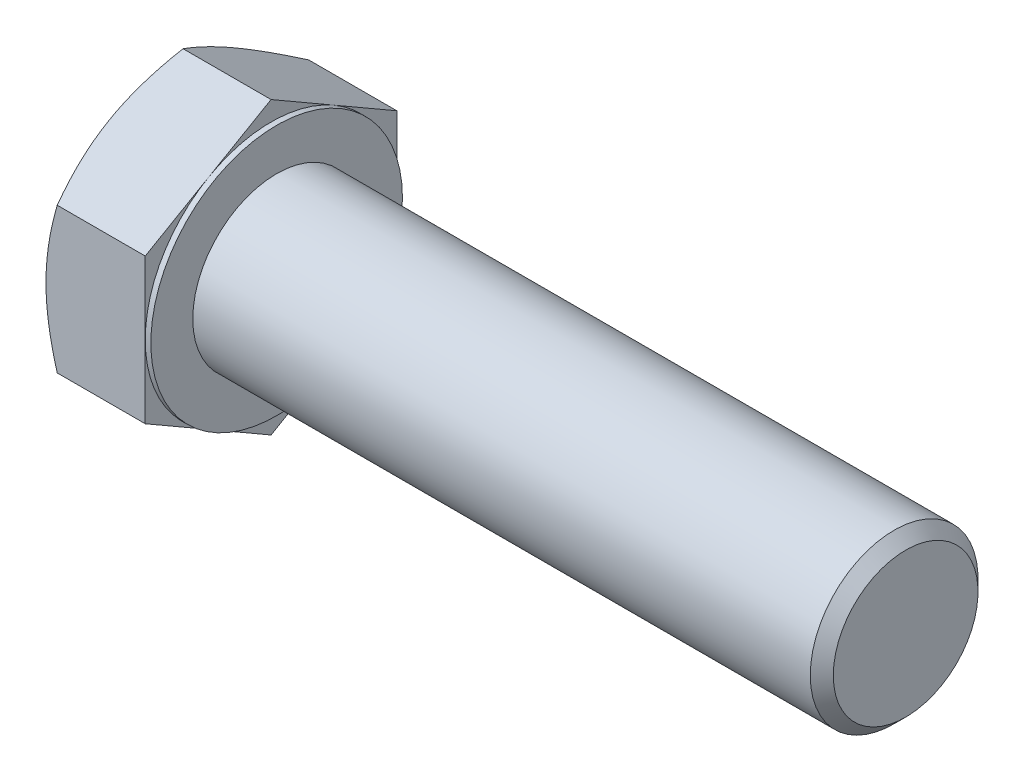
SolidWorks part; units mm, degrees
extrude "BaseHead" add sketch "Sketch1" along normal blind 15
sketch "Sketch1" plane through (0, 0, 0) normal (1, 0, 0) x (0, 0, -1)
  line L0 (18, 10.3923) -> (18, -10.3923)
  line L1 (-18, 10.3923) -> (-18, -10.3923)
  line L2 (18, -10.3923) -> (0, -20.7846)
  line L3 (0, -20.7846) -> (-18, -10.3923)
  line L4 (18, 10.3923) -> (0, 20.7846)
  line L5 (0, 20.7846) -> (-18, 10.3923)
revolve "HeadChamfer" cut sketch "Sketch3" angle 360 about L6
sketch "Sketch3" plane through (0, 0, 0) normal (0, 0, 1) x (1, 0, 0)
  line L0 (0, 18) -> (4.4944, 25.7846)
  line L1 (0, 20.7846) -> (0, 10.3923) construction
  line L2 (4.4944, 25.7846) -> (4.4944, 30.7846)
  line L3 (4.4944, 30.7846) -> (-10, 30.7846)
  line L4 (-10, 30.7846) -> (-10, 18)
  line L5 (-10, 18) -> (0, 18)
  line L6 (0, 0) -> (99.06, 0) construction
  line L7 (15, 20.7846) -> (0, 20.7846) construction
ref_plane "Plane1" through (0, 0, 0) normal (0, 0, 1) x (1, 0, 0)
ref_plane "Plane2" through (0, 0, 0) normal (0, 1, 0) x (1, 0, 0)
ref_plane "Plane3" through (0, 0, 0) normal (1, 0, 0) x (0, 0, -1)
sketch "BodySke" plane through (0, 0, 0) normal (0, 0, 1) x (1, 0, 0)
  line L0 (0, 10.3923) -> (0, -10.3923) construction
  line L1 (0, 0) -> (105, 0)
  line L2 (0, 0) -> (0, 12)
  line L3 (0, 12) -> (103.352, 12)
  line L4 (105, 0) -> (105, 10.352)
  line L5 (15, 20.7846) -> (15, 10.3923) construction
  line L6 (105, 10.352) -> (103.352, 12)
  line L7 (0, 0) -> (96.52, 0) construction
  line L8 (105, -10.352) -> (103.352, -12) construction
  line L9 (0, -12) -> (103.352, -12) construction
  line L10 (18, 15.24) -> (18, -1.27) construction
  line L11 (51, 15.24) -> (51, -1.27) construction
  line L12 (15, 10.3923) -> (15, -10.3923) construction
revolve "BaseBody" add sketch "BodySke"
fillet "HeadFillet" [suppressed] radius 0.8
sketch "Sketch4" plane through (0, 0, 0) normal (0, 0, 1) x (1, 0, 0)
  line L1 (15, 20.7846) -> (15, 10.3923) construction
  line L2 (15, 18) -> (14.2, 18)
  line L3 (15, 18) -> (15, 30.7846)
  line L4 (15, 30.7846) -> (14.2, 30.7846)
  line L5 (0, 0) -> (95.25, 0) construction
  line L6 (0, 0) -> (96.52, 0) construction
  line L7 (14.2, 18) -> (14.2, 30.7846)
  line L8 (15, 20.7846) -> (1.6077, 20.7846) construction
revolve "BearingFace" cut sketch "Sketch4" angle 360 about L5
sketch "ThdSchSke" plane through (0, 0, 0) normal (0, 0, 1) x (1, 0, 0)
  line L0 (51, -10.352) -> (49.8461, -12)
  line L1 (51, -10.352) -> (52.1539, -12)
  line L2 (52.1539, -12) -> (52.1539, -15)
  line L3 (-3.175, 0) -> (5.1513, 0) construction
  line L5 (52.1539, -15) -> (49.8461, -15)
  line L6 (49.8461, -15) -> (49.8461, -12)
revolve "ThreadSchematic" [suppressed] cut sketch "ThdSchSke" angle 360 about L3
pattern_linear "ThdSchPat" [suppressed]
equation "\"D3@Sketch1\" = \"Width_flats@Sketch1\" / 2"
equation "\"D4@Sketch1\" = \"D3@Sketch1\""
equation "\"D5@Sketch1\" = \"D4@Sketch1\""
equation "\"Thread_minor@ThreadCosmetic\" = \"Minor_dia@BodySke\""
equation "\"D1@Sketch3\" = \"Width_flats@Sketch1\" / 2"
equation "\"D1@Sketch4\" = \"Width_flats@Sketch1\""
equation "\"Thread_length@ThreadCosmetic\" = ((sgn( (\"Length@BodySke\" - \"Advance@BodySke\" ) - \"Thread_nom@BodySke\" )-1)*( (\"Length@BodySke\" - \"Advance@BodySke\" ) - \"Thread_nom@BodySke\" ))/-2+ \"Thread_nom@BodySke\""
equation "\"Thread_minor@ThdSchSke\" = \"Minor_dia@BodySke\""
equation "\"Diameter@ThdSchSke\" = \"Diameter@BodySke\""
equation "\"Overcut@ThdSchSke\" = \"Diameter@BodySke\" * 1.25"
equation "\"Start@ThdSchSke\" = \"Head_ht@BaseHead\" + \"Length@BodySke\" - \"Thread_length@ThreadCosmetic\"  '---Non-countersunk---"
equation "\"Num_threads@ThdSchPat\" = int( \"Thread_length@ThreadCosmetic\" / \"Advance@BodySke\" + 0.999 )  + 1"
equation "\"Advance@ThdSchPat\" = \"Thread_length@ThreadCosmetic\" /  (\"Num_threads@ThdSchPat\" - 1) 'relax it"
equation "\"Num_threads@ThdSchPat\" = \"Num_threads@ThdSchPat\" - sgn( \"Num_threads@ThdSchPat\" - 1) '---chamfered tips only---"
